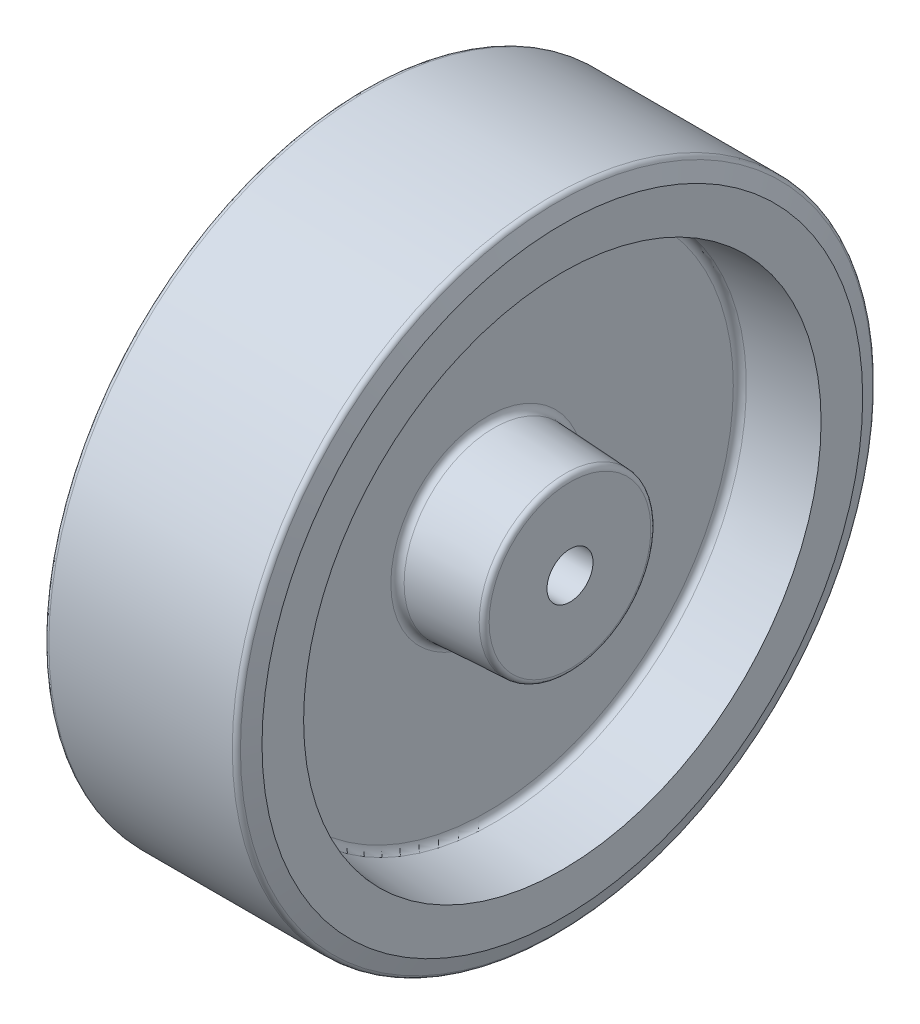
SolidWorks part; units mm, degrees
ref_plane "Piano frontale" through (0, 0, 0) normal (0, 0, 1) x (1, 0, 0)
ref_plane "Piano superiore" through (0, 0, 0) normal (0, 1, 0) x (1, 0, 0)
ref_plane "Piano destro" through (0, 0, 0) normal (1, 0, 0) x (0, 0, -1)
sketch "Schizzo1" plane through (0, 0, 0) normal (0, 0, 1) x (1, 0, 0)
  line L0 (-469.6749, 0) -> (23014.072, 0) construction
  line L1 (0, -469.6749) -> (0, 23014.072) construction
  line L2 (-43, 9) -> (43, 9)
  line L3 (43, 9) -> (43, 31.64)
  line L4 (41.1047, 33.6373) -> (13.2003, 35.0997)
  line L5 (10.67, 37.766) -> (10.67, 96.2079)
  line L6 (13.1073, 98.8677) -> (40, 101.2205)
  line L7 (40, 101.2205) -> (40, 117.5005)
  line L8 (40, 117.5005) -> (37.7494, 123.684)
  line L9 (35.87, 125) -> (-35.87, 125)
  line L10 (0, 125) -> (0, 9) construction
  line L11 (-40, 117.5005) -> (-37.7494, 123.684)
  line L12 (-40, 101.2205) -> (-40, 117.5005)
  line L13 (-13.1073, 98.8677) -> (-40, 101.2205)
  line L14 (-10.67, 37.766) -> (-10.67, 96.2079)
  line L15 (-41.1047, 33.6373) -> (-13.2003, 35.0997)
  line L16 (-43, 9) -> (-43, 31.64)
  arc A0 (43, 31.64) -> (41.1047, 33.6373) centre (41, 31.64) ccw
  arc A1 (37.7494, 123.684) -> (35.87, 125) centre (35.87, 123) ccw
  arc A2 (13.2003, 35.0997) -> (10.67, 37.766) centre (13.34, 37.766) cw
  arc A3 (10.67, 96.2079) -> (13.1073, 98.8677) centre (13.34, 96.2079) cw
  arc A4 (-37.7494, 123.684) -> (-35.87, 125) centre (-35.87, 123) cw
  arc A5 (-10.67, 96.2079) -> (-13.1073, 98.8677) centre (-13.34, 96.2079) ccw
  arc A6 (-13.2003, 35.0997) -> (-10.67, 37.766) centre (-13.34, 37.766) ccw
  arc A7 (-43, 31.64) -> (-41.1047, 33.6373) centre (-41, 31.64) cw
  dimension "D7" = 2
  dimension "D8" = 2.67
  dimension "D1" = 40
  dimension "D2" = 10.67
  dimension "D3" = 95
  dimension "D4" = 93
  dimension "D5" = 43
  dimension "D6" = 9
  dimension "D9" = 35.87
  dimension "D10" = 20
  dimension "D11" = 116
  dimension "D12" = 22.64
  dimension "D13" = 16.28
revolve "Rivoluzione1" add sketch "Schizzo1" angle 360 about L0
sketch "Schizzo2" plane through (0, 0, 0) normal (0, 1, 0) x (1, 0, 0)
  line L0 (43, 0) -> (-43, 0) construction
  line L1 (-43, 31.64) -> (-43, -31.64) construction
  point P6 (0, 0)
